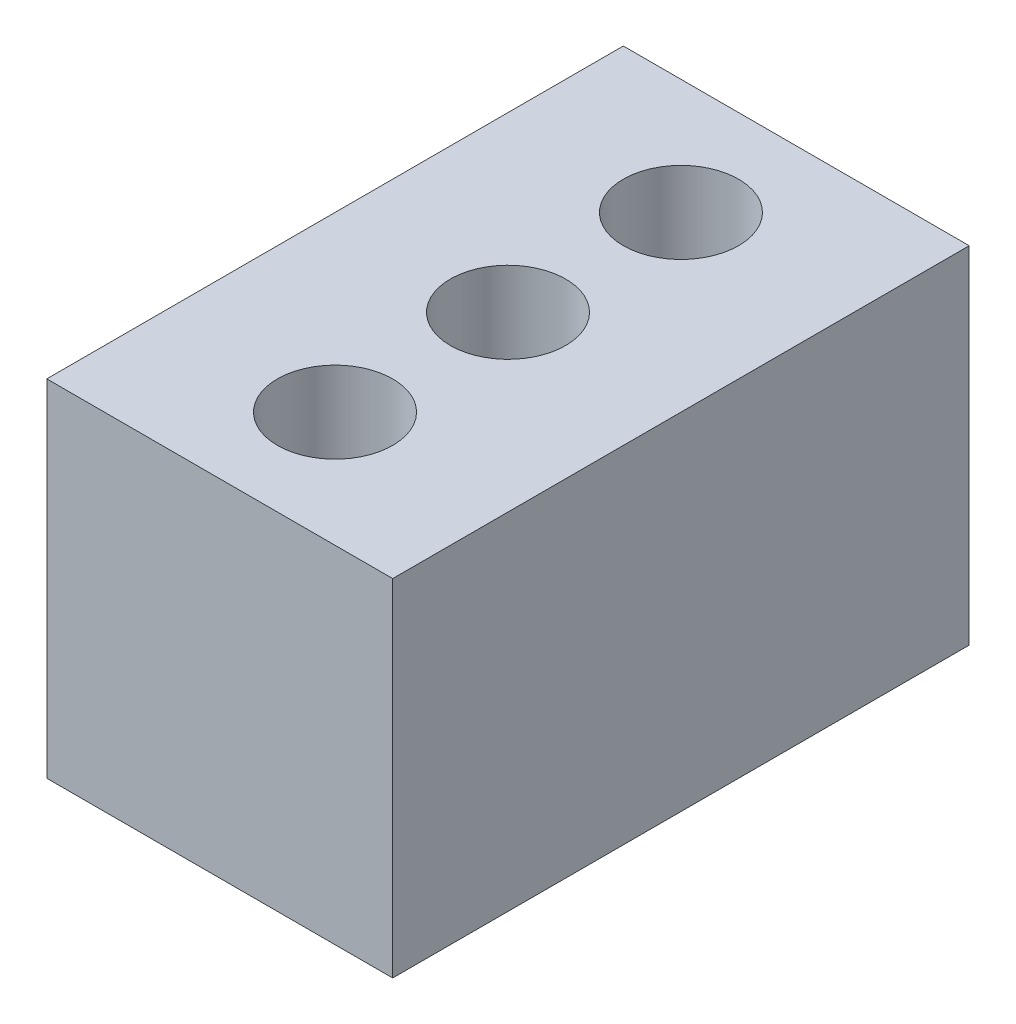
SolidWorks part; units mm, degrees
ref_plane "Face" through (0, 0, 0) normal (0, 0, 1) x (1, 0, 0)
ref_plane "Dessus" through (0, 0, 0) normal (0, 1, 0) x (1, 0, 0)
ref_plane "Droite" through (0, 0, 0) normal (1, 0, 0) x (0, 0, -1)
sketch "Esquisse2" plane through (0, 0, 0) normal (0, 0, 1) x (1, 0, 0)
  line L1 (0, 0) -> (30, 0)
  line L2 (0, 0) -> (0, -30)
  line L3 (0, -30) -> (30, -30)
  line L4 (30, 0) -> (30, -30)
  dimension "D1" = 30
  dimension "D2" = 30
extrude "Extrusion1" add sketch "Esquisse2" along normal blind 50
hole_wizard "Trou taraudé M121" positions "Esquisse4" profile "Esquisse3" tap size "M12" standard "ISO"
sketch "Esquisse4" plane through (0, 0, 0) normal (0, 1, 0) x (-1, 0, 0)
  line L0 (-30, 50) -> (-30, 0) construction
  line L1 (-30, 50) -> (0, 50) construction
  point P0 (-15, 40)
  dimension "D1" = 15
  dimension "D2" = 10
sketch "Esquisse3" plane through (15, 0, 40) normal (1, 0, 0) x (0, 0, 1)
  line L0 (0, 0) -> (0, 30)
  line L1 (0, 30) -> (5, 30)
  line L2 (5, 30) -> (5, 0)
  line L5 (5, 0) -> (0, 0)
  line L11 (0, -6.35) -> (0, 107.95) construction
  dimension "Diamètre du trou pour taraudage jusqu'au prochain" = 10
  dimension "Profondeur du trou pour taraudage jusqu'au prochain" = 30
hole_wizard "Trou taraudé M61" positions "Esquisse7" profile "Esquisse6" tap size "M6" standard "ISO"
sketch "Esquisse7" plane through (0, 0, 0) normal (0, 0, -1) x (-1, 0, 0)
  line L0 (0, 0) -> (0, -30) construction
  line L1 (-30, 0) -> (0, 0) construction
  point P0 (-6, -6)
  dimension "D1" = 6
  dimension "D2" = 6
sketch "Esquisse6" plane through (6, -6, 0) normal (1, 0, 0) x (0, 1, 0)
  line L0 (0, 0) -> (0, 14.5022)
  line L1 (0, 14.5022) -> (2.5, 13)
  line L2 (2.5, 13) -> (2.5, 0)
  line L5 (2.5, 0) -> (0, 0)
  line L10 (0, 14.5022) -> (-2.5, 13) construction
  line L11 (0, -6.35) -> (0, 107.95) construction
  dimension "Diamètre du trou pour taraudage" = 5
  dimension "Profondeur du trou pour taraudage" = 13
  dimension "Angle de pointe" = 118
pattern_linear "Répétition linéaire1" count 2 spacing 18 along (1, 0, 0) of "Trou taraudé M61"
pattern_linear "Répétition linéaire2" count 2 spacing 18 along (0, -1, 0) of "Répétition linéaire1", "Trou taraudé M61"
pattern_linear "Répétition linéaire4" count 3 spacing 15 along (0, 0, -1) of "Trou taraudé M121"
